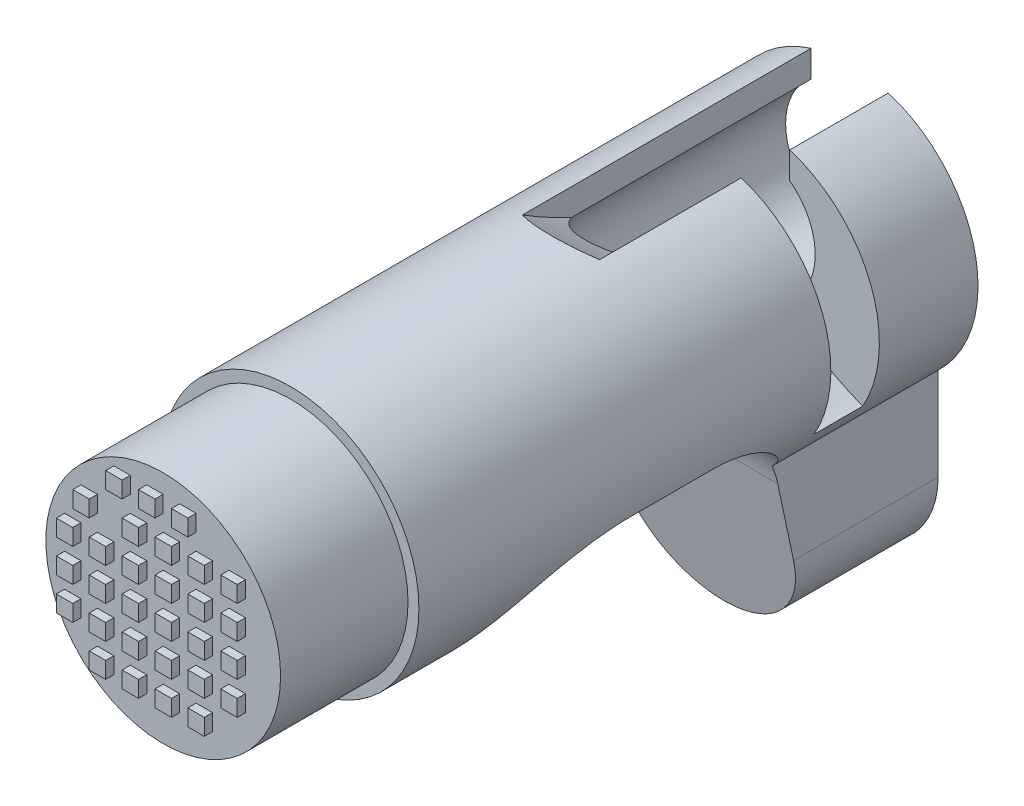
SolidWorks part; units mm, degrees
ref_plane "Front Plane" through (0, 0, 0) normal (0, 0, 1) x (1, 0, 0)
ref_plane "Top Plane" through (0, 0, 0) normal (0, 1, 0) x (1, 0, 0)
ref_plane "Right Plane" through (0, 0, 0) normal (1, 0, 0) x (0, 0, -1)
sketch "Sketch1" plane through (0, 0, 0) normal (0, 0, 1) x (1, 0, 0)
  line L0 (0, 3.9624) -> (5.6937, 3.9624) construction
  line L1 (0, -8.4582) -> (5.3331, -8.4582) construction
  line L2 (-2.7305, -5.7277) -> (-2.7305, -2.8714)
  line L3 (0, 0) -> (0, -10.2964) construction
  line L4 (2.7305, -5.7277) -> (2.7305, -2.8714)
  arc A0 (2.7305, -2.8714) -> (-2.7305, -2.8714) centre (0, 0) ccw
  arc A1 (-2.7305, -5.7277) -> (2.7305, -5.7277) centre (0, -5.7277) ccw
  dimension "D1" = 7.9248
  dimension "D2" = 5.461
  dimension "D3" = 12.4206
extrude "Boss-Extrude1" add sketch "Sketch1" along normal blind 21.463
sketch "Sketch2" plane through (0, 0, 0) normal (1, 0, 0) x (0, 0, -1)
  line L0 (0, 0) -> (-25.3927, 0) construction
  line L1 (-8.0607, -0.9144) -> (-24.2133, -0.9144)
  line L2 (0, 3.9624) -> (-21.463, 3.9624) construction
  line L3 (-17.6784, 5.172) -> (-17.6784, -12.4998) construction
  line L4 (0, -2.8714) -> (0, 3.9624) construction
  line L5 (-16.9164, 5.172) -> (-16.9164, -12.0845) construction
  line L6 (-3.8862, 5.172) -> (-3.8862, -12.4998) construction
  line L7 (0, -3.3241) -> (0, -9.935) construction
  line L8 (0, -8.4582) -> (0, -5.7277) construction
  line L9 (-3.8862, 5.172) -> (-3.8862, -9.8944) construction
  line L10 (-16.9164, 5.172) -> (-16.9164, -9.8944) construction
  line L11 (-17.6784, 5.172) -> (-17.6784, -9.8944) construction
  line L20 (0, -2.8714) -> (0, -5.7277) construction
  line L21 (0, -8.4582) -> (0, -5.7277)
  line L22 (-3.8862, -8.4582) -> (-4.9551, -3.4293)
  line L23 (0, -8.4582) -> (-4.9078, -8.4582) construction
  line L24 (-16.9164, -7.2644) -> (-16.9164, -9.1669)
  line L25 (-16.9164, -9.1669) -> (-3.8862, -9.1669)
  line L26 (-3.8862, -9.1669) -> (-3.8862, -8.4582)
  arc A0 (-4.9551, -3.4293) -> (-8.0607, -0.9144) centre (-8.0607, -4.0894) ccw
  arc A1 (-10.5664, -0.9144) -> (-16.9164, -7.2644) centre (-10.5664, -7.2644) ccw
  arc A2 (-4.3296, -8.4582) -> (-4.2637, -8.0382) centre (-10.5664, -7.2644) ccw
  point P19 (-3.8862, -8.4582)
  dimension "D6" = 6.35
  dimension "D7" = 12.7
  dimension "D1" = 4.8768
  dimension "D2" = 17.6784
  dimension "D5" = 12
  dimension "D3" = 0.762
  dimension "D4" = 13.7922
extrude "Cut-Extrude1" cut sketch "Sketch2" against normal mid plane 21.463
ref_plane "Plane1" through (0, 0, 16.9164) normal (0, 0, -1) x (-1, 0, 0)
sketch "Sketch3" plane through (0, 0, 16.9164) normal (0, 0, -1) x (-1, 0, 0)
  line L0 (2.7305, -2.8714) -> (2.7305, -5.7277) construction
  line L1 (-2.7305, -5.7277) -> (-2.7305, -2.8714) construction
  line L2 (2.7305, -2.8714) -> (2.7305, -5.7277)
  line L3 (-2.7305, -5.7277) -> (-2.7305, -2.8714)
  arc A1 (-2.7305, -2.8714) -> (2.7305, -2.8714) centre (0, 0) ccw
  arc A2 (-2.7305, -5.7277) -> (2.7305, -5.7277) centre (0, -5.7277) ccw construction
  arc A3 (-2.7305, -5.7277) -> (2.7305, -5.7277) centre (0, -5.7277) ccw
extrude "Cut-Extrude2" cut sketch "Sketch3" against normal mid plane 13.589
sketch "Sketch5" plane through (0, 0, 0) normal (0, 0, -1) x (-1, 0, 0)
  line L0 (-3.4111, 0) -> (4.9931, 0) construction
  line L1 (-3.4111, 1.3716) -> (4.9931, 1.3716) construction
  line L2 (0, 9.248) -> (0, -9.248) construction
  line L3 (-1.1938, 3.7783) -> (-1.1938, 2.9527)
  line L4 (1.1938, 2.9527) -> (1.1938, 3.7783)
  line L5 (0, 0) -> (0, 5.5697) construction
  arc A0 (-1.1938, 2.9527) -> (1.1938, 2.9527) centre (0, 1.3716) ccw
  arc A1 (2.7305, -2.8714) -> (-2.7305, -2.8714) centre (0, 0) ccw construction
  arc A2 (2.7305, -2.8714) -> (3.7174, 1.3716) centre (0, 0) ccw
  arc A3 (1.1938, 3.7783) -> (-1.1938, 3.7783) centre (0, 0) ccw
  dimension "D3" = 2.3876
  dimension "D1" = 1.3716
extrude "Cut-Extrude3" cut sketch "Sketch5" against normal blind 6.35 contours A0 L4 A3 L3
sketch "Sketch6" plane through (0, 0, 6.35) normal (0, 0, -1) x (-1, 0, 0)
  circle A0 centre (0, 1.3716) radius 1.9812
  arc A1 (-1.1938, 2.9527) -> (1.1938, 2.9527) centre (0, 1.3716) ccw construction
extrude "Cut-Extrude5" cut sketch "Sketch6" against normal blind 11.0744
sketch "Sketch7" plane through (0, 0, 0) normal (1, 0, 0) x (0, 0, -1)
  line L0 (0, 3.3186) -> (0, 18.0773) construction
  line L1 (0, -2.8714) -> (0, 3.7783) construction
  circle A0 centre (-1.016, 16.51) radius 14.986
  dimension "D2" = 29.972
  dimension "D1" = 16.51
  dimension "D3" = 1.016
extrude "Cut-Extrude6" cut sketch "Sketch7" along normal up to surface and the other way up to surface
sketch "Sketch9" plane through (0, 0, 21.463) normal (0, 0, 1) x (1, 0, 0)
  circle A0 centre (0, 0) radius 3.6258
  circle A1 centre (0, 0) radius 3.9624 construction
  circle A2 centre (0, 0) radius 3.9624
  dimension "D1" = 7.2517
extrude "Cut-Extrude7" cut sketch "Sketch9" against normal blind 4.191
sketch "Sketch10" plane through (0, 0, 0) normal (0, 0, -1) x (-1, 0, 0)
  line L0 (0, 0) -> (0, 6.0644) construction
  line L1 (0, 0) -> (-6.0578, 0) construction
  circle A0 centre (-5.969, 4.699) radius 4.3333 construction
  dimension "D1" = 4.699
  dimension "D2" = 5.969
sketch "Sketch11" plane through (0, 0, 17.272) normal (0, 0, 1) x (1, 0, 0)
  circle A0 centre (5.969, 4.699) radius 4.3333 construction
  circle A1 centre (5.969, 4.699) radius 4.3333
ref_plane "Plane2" through (0, 0, 3.048) normal (0, 0, 1) x (1, 0, 0)
sketch "Sketch12" plane through (0, 0, 3.048) normal (0, 0, 1) x (1, 0, 0)
  circle A0 centre (5.969, 4.699) radius 4.3333 construction
  circle A1 centre (5.969, 4.699) radius 4.3333 construction
  circle A2 centre (5.969, 4.699) radius 7.112
  dimension "D1" = 14.224
extrude "Cut-Extrude8" cut sketch "Sketch12" along normal blind 1.4986
sketch "Sketch13" plane through (0, 0, 21.463) normal (0, 0, 1) x (1, 0, 0)
  line L0 (0, 3.048) -> (0, 2.54)
  line L1 (-3.048, 0) -> (-2.54, 0)
  line L2 (-3.048, -0.508) -> (-2.54, -0.508)
  line L3 (-3.048, -1.016) -> (-2.54, -1.016)
  line L4 (-3.048, -1.524) -> (-2.54, -1.524)
  line L5 (-2.032, -2.032) -> (-1.524, -2.032)
  line L6 (-2.032, -2.54) -> (-1.524, -2.54)
  line L7 (-1.016, 2.032) -> (-0.508, 2.032)
  line L8 (-1.524, 3.048) -> (-1.016, 3.048)
  line L9 (-1.524, 2.54) -> (-1.016, 2.54)
  line L10 (-2.54, 2.032) -> (-2.032, 2.032)
  line L11 (-2.54, 1.524) -> (-2.032, 1.524)
  line L12 (-3.048, 1.016) -> (-2.54, 1.016)
  line L13 (-3.048, 0.508) -> (-2.54, 0.508)
  line L14 (0.508, 3.048) -> (0.508, 2.54)
  line L15 (1.016, 3.048) -> (1.016, 2.54)
  line L17 (2.032, 2.032) -> (2.032, 1.524)
  line L18 (2.54, 2.032) -> (2.54, 1.524)
  line L20 (0, 2.032) -> (0.508, 2.032)
  line L21 (-2.54, 2.032) -> (-2.54, 1.524)
  line L22 (-2.032, 2.032) -> (-2.032, 1.524)
  line L23 (-1.524, 3.048) -> (-1.524, 2.54)
  line L24 (-1.016, 3.048) -> (-1.016, 2.54)
  line L25 (-0.508, 3.048) -> (-0.508, 2.54)
  line L26 (2.54, 0.508) -> (2.032, 0.508)
  line L27 (2.54, 1.016) -> (2.032, 1.016)
  line L28 (2.54, 1.524) -> (2.032, 1.524)
  line L29 (2.54, 2.032) -> (2.032, 2.032)
  line L30 (-3.048, 1.016) -> (-3.048, 0.508)
  line L31 (1.524, -2.54) -> (1.016, -2.54)
  line L32 (1.524, -2.032) -> (1.016, -2.032)
  line L33 (2.54, -1.524) -> (2.032, -1.524)
  line L34 (2.54, -1.016) -> (2.032, -1.016)
  line L35 (2.54, -0.508) -> (2.032, -0.508)
  line L36 (2.54, 0) -> (2.032, 0)
  line L37 (-2.032, 2.032) -> (-2.54, 2.032)
  line L38 (-1.016, 2.032) -> (-1.016, 1.524)
  line L39 (-0.508, 2.032) -> (-0.508, 1.524)
  line L40 (0, 2.032) -> (0, 1.524)
  line L41 (0.508, 2.032) -> (0.508, 1.524)
  line L42 (1.016, 2.032) -> (1.016, 1.524)
  line L43 (1.524, 2.032) -> (1.524, 1.524)
  line L44 (-2.54, 1.016) -> (-2.54, 0.508)
  line L45 (-2.032, 1.016) -> (-2.032, 0.508)
  line L46 (-1.524, 1.016) -> (-1.524, 0.508)
  line L47 (-1.016, 1.016) -> (-1.016, 0.508)
  line L48 (-0.508, 1.016) -> (-0.508, 0.508)
  line L49 (0, 1.016) -> (0, 0.508)
  line L50 (0.508, 1.016) -> (0.508, 0.508)
  line L51 (1.016, 1.016) -> (1.016, 0.508)
  line L52 (1.524, 1.016) -> (1.524, 0.508)
  line L53 (2.032, 1.016) -> (2.032, 0.508)
  line L54 (2.54, 1.016) -> (2.54, 0.508)
  line L55 (-3.048, 0) -> (-3.048, -0.508)
  line L56 (-2.54, 0) -> (-2.54, -0.508)
  line L57 (-2.032, 0) -> (-2.032, -0.508)
  line L58 (-1.524, 0) -> (-1.524, -0.508)
  line L59 (-1.016, 0) -> (-1.016, -0.508)
  line L60 (-0.508, 0) -> (-0.508, -0.508)
  line L61 (0, 0) -> (0, -0.508)
  line L62 (0.508, 0) -> (0.508, -0.508)
  line L63 (1.016, 0) -> (1.016, -0.508)
  line L64 (1.524, 0) -> (1.524, -0.508)
  line L65 (2.032, 0) -> (2.032, -0.508)
  line L66 (2.54, 0) -> (2.54, -0.508)
  line L68 (-3.048, -1.016) -> (-3.048, -1.524)
  line L69 (-2.54, -1.016) -> (-2.54, -1.524)
  line L70 (-2.032, -1.016) -> (-2.032, -1.524)
  line L71 (-1.524, -1.016) -> (-1.524, -1.524)
  line L72 (-1.016, -1.016) -> (-1.016, -1.524)
  line L73 (-0.508, -1.016) -> (-0.508, -1.524)
  line L74 (0, -1.016) -> (0, -1.524)
  line L75 (0.508, -1.016) -> (0.508, -1.524)
  line L76 (1.016, -1.016) -> (1.016, -1.524)
  line L77 (1.524, -1.016) -> (1.524, -1.524)
  line L78 (2.032, -1.016) -> (2.032, -1.524)
  line L79 (2.54, -1.016) -> (2.54, -1.524)
  line L81 (-2.032, -2.032) -> (-2.032, -2.54)
  line L82 (-1.524, -2.032) -> (-1.524, -2.54)
  line L83 (-1.016, -2.032) -> (-1.016, -2.54)
  line L84 (-0.508, -2.032) -> (-0.508, -2.54)
  line L85 (0, -2.032) -> (0, -2.54)
  line L86 (0.508, -2.032) -> (0.508, -2.54)
  line L87 (1.016, -2.032) -> (1.016, -2.54)
  line L88 (1.524, -2.032) -> (1.524, -2.54)
  line L90 (-1.524, -3.048) -> (1.524, -3.048)
  line L91 (-1.016, 1.524) -> (-0.508, 1.524)
  line L92 (-2.032, 1.524) -> (-2.54, 1.524)
  line L93 (-2.032, 1.016) -> (-1.524, 1.016)
  line L94 (-2.54, 1.016) -> (-3.048, 1.016)
  line L95 (-2.032, 0.508) -> (-1.524, 0.508)
  line L96 (-2.54, 0.508) -> (-3.048, 0.508)
  line L97 (-2.032, 0) -> (-1.524, 0)
  line L98 (-2.54, 0) -> (-3.048, 0)
  line L99 (-2.032, -0.508) -> (-1.524, -0.508)
  line L100 (-2.54, -0.508) -> (-3.048, -0.508)
  line L101 (-2.032, -1.016) -> (-1.524, -1.016)
  line L102 (-2.54, -1.016) -> (-3.048, -1.016)
  line L103 (-2.032, -1.524) -> (-1.524, -1.524)
  line L104 (-2.54, -1.524) -> (-3.048, -1.524)
  line L105 (-1.016, -2.54) -> (-0.508, -2.54)
  line L106 (-1.524, -2.54) -> (-2.032, -2.54)
  line L107 (-1.016, -2.032) -> (-0.508, -2.032)
  line L108 (-1.524, -2.032) -> (-2.032, -2.032)
  line L109 (-1.524, -1.524) -> (-2.032, -1.524)
  line L110 (-1.016, -1.524) -> (-0.508, -1.524)
  line L111 (-1.524, -1.016) -> (-2.032, -1.016)
  line L112 (-1.016, -1.016) -> (-0.508, -1.016)
  line L113 (-1.524, -0.508) -> (-2.032, -0.508)
  line L114 (-1.016, -0.508) -> (-0.508, -0.508)
  line L115 (-1.524, 0) -> (-2.032, 0)
  line L116 (-1.016, 0) -> (-0.508, 0)
  line L117 (-1.524, 0.508) -> (-2.032, 0.508)
  line L118 (-1.016, 0.508) -> (-0.508, 0.508)
  line L119 (-1.524, 1.016) -> (-2.032, 1.016)
  line L120 (-1.016, 1.016) -> (-0.508, 1.016)
  line L121 (-0.508, 2.54) -> (0, 2.54)
  line L122 (-0.508, 3.048) -> (0, 3.048)
  line L123 (-0.508, 2.032) -> (-1.016, 2.032)
  line L124 (-0.508, 1.524) -> (-1.016, 1.524)
  line L125 (0, 1.524) -> (0.508, 1.524)
  line L126 (-0.508, 1.016) -> (-1.016, 1.016)
  line L127 (0, 1.016) -> (0.508, 1.016)
  line L128 (-0.508, 0.508) -> (-1.016, 0.508)
  line L129 (0, 0.508) -> (0.508, 0.508)
  line L130 (-0.508, 0) -> (-1.016, 0)
  line L131 (0, 0) -> (0.508, 0)
  line L132 (-0.508, -0.508) -> (-1.016, -0.508)
  line L133 (0, -0.508) -> (0.508, -0.508)
  line L134 (-0.508, -1.016) -> (-1.016, -1.016)
  line L135 (0, -1.016) -> (0.508, -1.016)
  line L136 (-0.508, -1.524) -> (-1.016, -1.524)
  line L137 (0, -1.524) -> (0.508, -1.524)
  line L138 (-0.508, -2.032) -> (-1.016, -2.032)
  line L139 (0, -2.032) -> (0.508, -2.032)
  line L140 (-0.508, -2.54) -> (-1.016, -2.54)
  line L141 (0, -2.54) -> (0.508, -2.54)
  line L142 (0.508, -2.54) -> (0, -2.54)
  line L143 (1.016, -2.54) -> (1.524, -2.54)
  line L144 (0.508, -2.032) -> (0, -2.032)
  line L145 (1.016, -2.032) -> (1.524, -2.032)
  line L146 (0.508, -1.524) -> (0, -1.524)
  line L147 (1.016, -1.524) -> (1.524, -1.524)
  line L148 (0.508, -1.016) -> (0, -1.016)
  line L149 (1.016, -1.016) -> (1.524, -1.016)
  line L150 (0.508, -0.508) -> (0, -0.508)
  line L151 (1.016, -0.508) -> (1.524, -0.508)
  line L152 (0.508, 0) -> (0, 0)
  line L153 (1.016, 0) -> (1.524, 0)
  line L154 (0.508, 0.508) -> (0, 0.508)
  line L155 (1.016, 0.508) -> (1.524, 0.508)
  line L156 (0.508, 1.016) -> (0, 1.016)
  line L157 (1.016, 1.016) -> (1.524, 1.016)
  line L158 (0.508, 1.524) -> (0, 1.524)
  line L159 (1.016, 1.524) -> (1.524, 1.524)
  line L160 (1.016, 2.032) -> (1.524, 2.032)
  line L161 (0.508, 2.032) -> (0, 2.032)
  line L162 (0.508, 2.54) -> (1.016, 2.54)
  line L163 (0.508, 3.048) -> (1.016, 3.048)
  line L164 (1.524, 3.048) -> (1.524, 2.54)
  line L165 (1.524, 2.032) -> (1.016, 2.032)
  line L166 (2.032, 2.032) -> (2.54, 2.032)
  line L167 (1.524, 1.524) -> (1.016, 1.524)
  line L168 (2.032, 1.524) -> (2.54, 1.524)
  line L169 (1.524, 1.016) -> (1.016, 1.016)
  line L170 (2.032, 1.016) -> (2.54, 1.016)
  line L171 (1.524, 0.508) -> (1.016, 0.508)
  line L172 (2.032, 0.508) -> (2.54, 0.508)
  line L173 (1.524, 0) -> (1.016, 0)
  line L174 (2.032, 0) -> (2.54, 0)
  line L175 (1.524, -0.508) -> (1.016, -0.508)
  line L176 (2.032, -0.508) -> (2.54, -0.508)
  line L177 (1.524, -1.016) -> (1.016, -1.016)
  line L178 (2.032, -1.016) -> (2.54, -1.016)
  line L179 (1.524, -1.524) -> (1.016, -1.524)
  line L180 (2.032, -1.524) -> (2.54, -1.524)
  line L181 (3.048, 1.016) -> (3.048, 0.508)
  dimension "D1" = 7
  dimension "D2" = 7
extrude "Cut-Extrude9" cut sketch "Sketch13" against normal blind 0.254 contours L42 L160 L43 L159 L63 L153 L64 L151 L25 L122 L0 L121 L59 L116 L60 L114 L83 L107 L84 L105 L103 L70 L101 L71 L99 L57 L97 L58 L95 L45 L93 L46 L91 L38 L7 L39 L5 L82 L6 L81 M8
